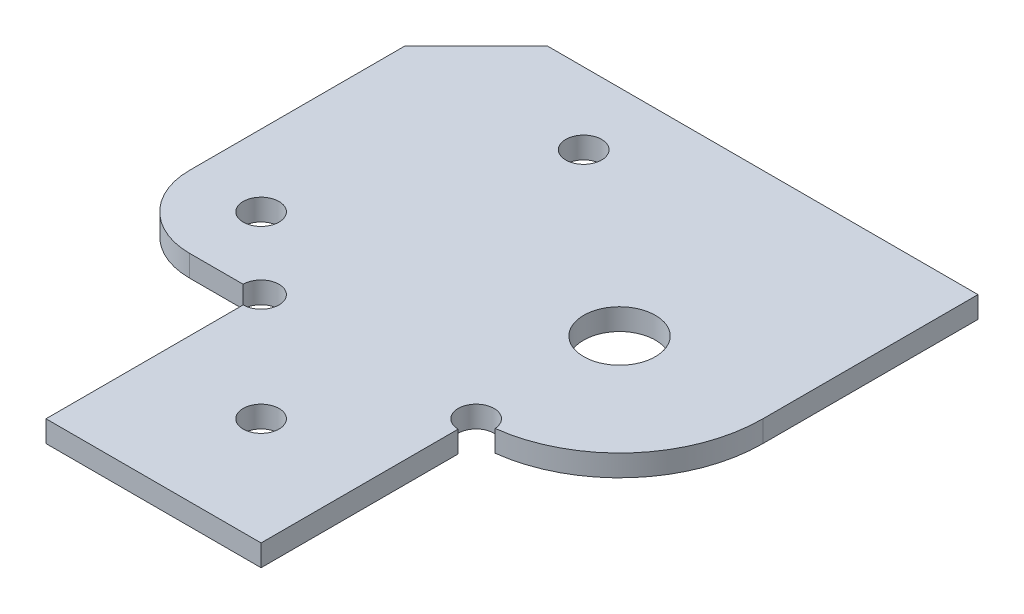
SolidWorks part; units mm, degrees
ref_plane "Front" through (0, 0, 0) normal (0, 0, 1) x (1, 0, 0)
ref_plane "Top" through (0, 0, 0) normal (0, 1, 0) x (1, 0, 0)
ref_plane "Right" through (0, 0, 0) normal (1, 0, 0) x (0, 0, -1)
sketch "Sketch1" plane through (0, 0, 0) normal (0, 1, 0) x (1, 0, 0)
  line L1 (20, 0) -> (50, 0)
  line L2 (0, 40) -> (0, 70)
  line L3 (10, 80) -> (70, 80)
  line L4 (70, 50) -> (70, 80)
  line L6 (10, 30) -> (17.5, 30)
  line L7 (50, 0) -> (50, 27.5)
  line L8 (20, 0) -> (20, 27.5)
  line L9 (10, 80) -> (0, 70)
  line L14 (0, 0) -> (70, 0) construction
  line L16 (0, 30) -> (70, 30) construction
  circle A0 centre (35, 15) radius 2.5
  arc A1 (20, 27.5) -> (17.5, 30) centre (20, 30) ccw
  arc A2 (52.4951, 30.1562) -> (50, 27.5) centre (50, 30) ccw
  arc A3 (52.4951, 30.1562) -> (70, 50) centre (50, 50) ccw
  arc A4 (0, 40) -> (10, 30) centre (10, 40) ccw
  circle A5 centre (10, 40) radius 2.5
  circle A6 centre (50, 50) radius 5
  circle A7 centre (25, 70) radius 2.5
  dimension "D1" = 5
extrude "Extrude1" add sketch "Sketch1" along normal blind 3
